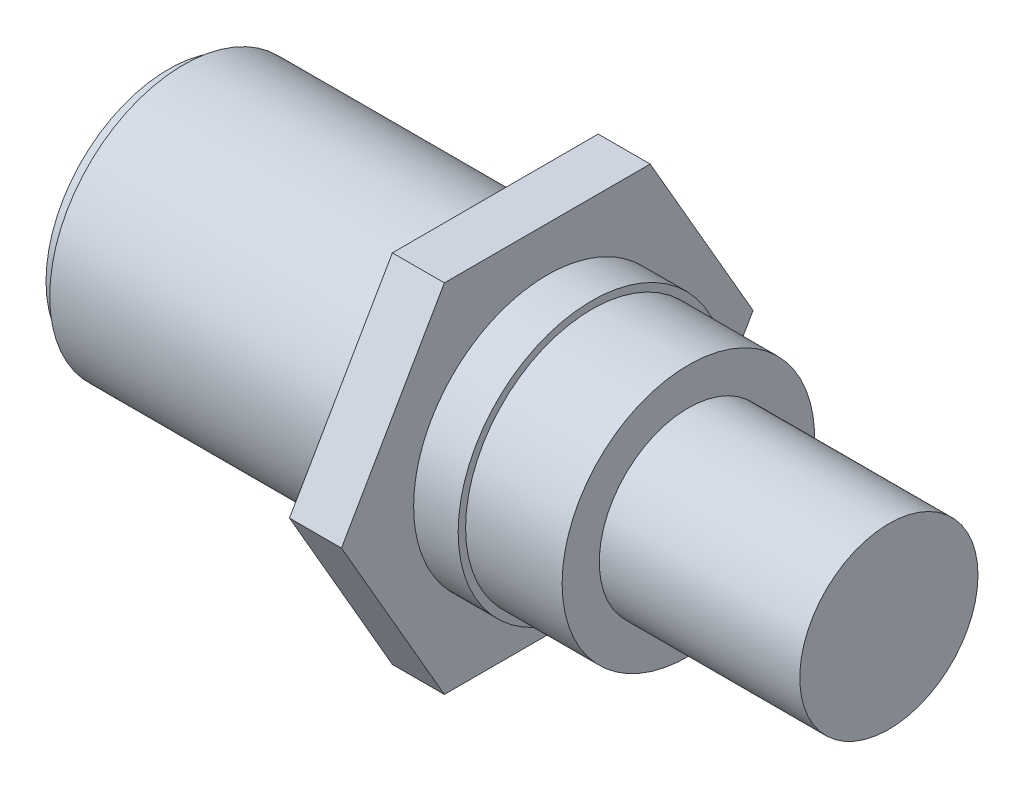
SolidWorks part; units mm, degrees
ref_plane "Plan de face" through (0, 0, 0) normal (0, 0, 1) x (1, 0, 0)
ref_plane "Plan de dessus" through (0, 0, 0) normal (0, 1, 0) x (1, 0, 0)
ref_plane "Plan de droite" through (0, 0, 0) normal (1, 0, 0) x (0, 0, -1)
sketch "Esquisse1" plane through (0, 0, 0) normal (0, 0, 1) x (1, 0, 0)
  line L1 (0, 0) -> (27.5, 0)
  line L2 (0, 0) -> (0, 9)
  line L3 (0, 9) -> (27.5, 9)
  line L4 (27.5, 0) -> (27.5, 9)
  dimension "D1" = 27.5
  dimension "D2" = 9
revolve "Révolution1" add sketch "Esquisse1" angle 360 about L1
sketch "Esquisse2" plane through (0, 0, 0) normal (-1, 0, 0) x (0, 0, 1)
  circle A0 centre (0, 0) radius 8.25
  dimension "D1" = 16.5
extrude "Extrusion1" add sketch "Esquisse2" along normal blind 1
sketch "Esquisse3" plane through (27.5, 0, 0) normal (1, 0, 0) x (0, 0, -1)
  circle A0 centre (0, 0) radius 8.5
  dimension "D1" = 17
extrude "Extrusion2" add sketch "Esquisse3" along normal blind 6.5
ref_plane "Plan1" through (45, 0, 0) normal (1, 0, 0) x (0, 0, -1)
sketch "Esquisse4" plane through (34, 0, 0) normal (1, 0, 0) x (0, 0, -1)
  circle A0 centre (0, 0) radius 6
  circle A1 centre (0, 0) radius 8.5 construction
  dimension "D2" = 12
extrude "Extrusion3" add sketch "Esquisse4" along normal blind 13.5
ref_plane "Plan2" through (21, 0, 0) normal (1, 0, 0) x (0, 0, -1)
sketch "Esquisse5" plane through (21, 0, 0) normal (1, 0, 0) x (0, 0, -1)
  line L1 (6.9282, 12) -> (-6.9282, 12)
  line L2 (-6.9282, 12) -> (-13.8564, 0)
  line L3 (-13.8564, 0) -> (-6.9282, -12)
  line L4 (-6.9282, -12) -> (6.9282, -12)
  line L5 (6.9282, -12) -> (13.8564, 0)
  line L6 (13.8564, 0) -> (6.9282, 12)
  circle A0 centre (0, 0) radius 12 construction
  circle A1 centre (0, 0) radius 9
  dimension "D2" = 18
  dimension "D1" = 24
extrude "Extrusion4" add sketch "Esquisse5" along normal blind 3.5 separate body
pattern_linear "Répétition linéaire2" [suppressed] count 2 spacing 6 along (1, 0, 0)
